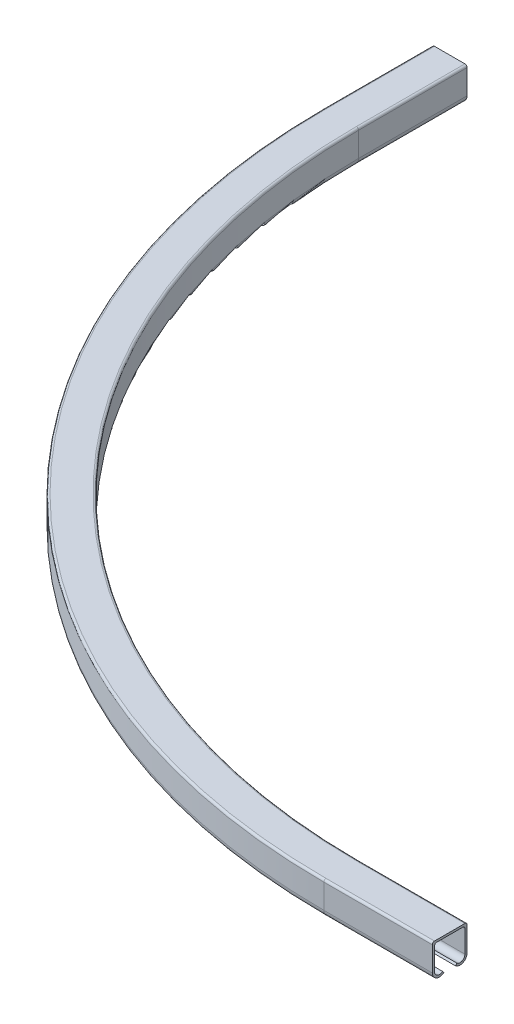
SolidWorks part; units mm, degrees
ref_plane "Front" through (0, 0, 0) normal (0, 0, 1) x (1, 0, 0)
ref_plane "Top" through (0, 0, 0) normal (0, 1, 0) x (1, 0, 0)
ref_plane "Right" through (0, 0, 0) normal (1, 0, 0) x (0, 0, -1)
ref_plane "Plane1" through (0, 0, -100) normal (0, 0, 1) x (1, 0, 0)
sketch "Sketch1" plane through (0, 0, -100) normal (0, 0, 1) x (1, 0, 0)
  line L0 (0, -2.9123) -> (0, 61.7129) construction
  line L1 (0, 0) -> (-16, 0)
  line L2 (-16, 0) -> (-16, -24.5)
  line L3 (0, -2) -> (-14, -2)
  line L4 (-14, -2) -> (-14, -24.5)
  line L5 (-6.5923, -27.9344) -> (-5.3, -29.4608)
  line L6 (6.5923, -27.9344) -> (5.3, -29.4608)
  line L7 (14, -2) -> (14, -24.5)
  line L8 (0, -2) -> (14, -2)
  line L9 (16, 0) -> (16, -24.5)
  line L10 (0, 0) -> (16, 0)
  arc A0 (-16, -24.5) -> (-5.3, -29.4608) centre (-9.5, -24.5) ccw
  arc A1 (-14, -24.5) -> (-6.5923, -27.9344) centre (-9.5, -24.5) ccw
  arc A2 (14, -24.5) -> (6.5923, -27.9344) centre (9.5, -24.5) cw
  arc A3 (16, -24.5) -> (5.3, -29.4608) centre (9.5, -24.5) cw
  dimension "D3" = 4.5
  dimension "D4" = 31
  dimension "D1" = 32
  dimension "D2" = 10.6
  dimension "D5" = 2
sketch "Sketch2" plane through (0, 0, 0) normal (0, 1, 0) x (1, 0, 0)
  line L0 (0, 0) -> (0, 100)
  line L1 (600, -600) -> (700, -600)
  arc A0 (0, 0) -> (600, -600) centre (600, 0) ccw
  dimension "D1" = 1200
  dimension "D2" = 100
  dimension "D3" = 100
sweep "Sweep1" add profiles "Sketch1" path "Sketch2"
fillet "Fillet1" radius 2 12 edges at (-16, 0, -50) (16, 0, -50) (14, -2, -50) (-14, -2, -50) (164.4222, 0, 435.5778) (187.0496, 0, 412.9504) (185.6354, -2, 414.3646) (165.8364, -2, 434.1636) (650, 0, 616) (650, 0, 584) (650, -2, 586) (650, -2, 614)
